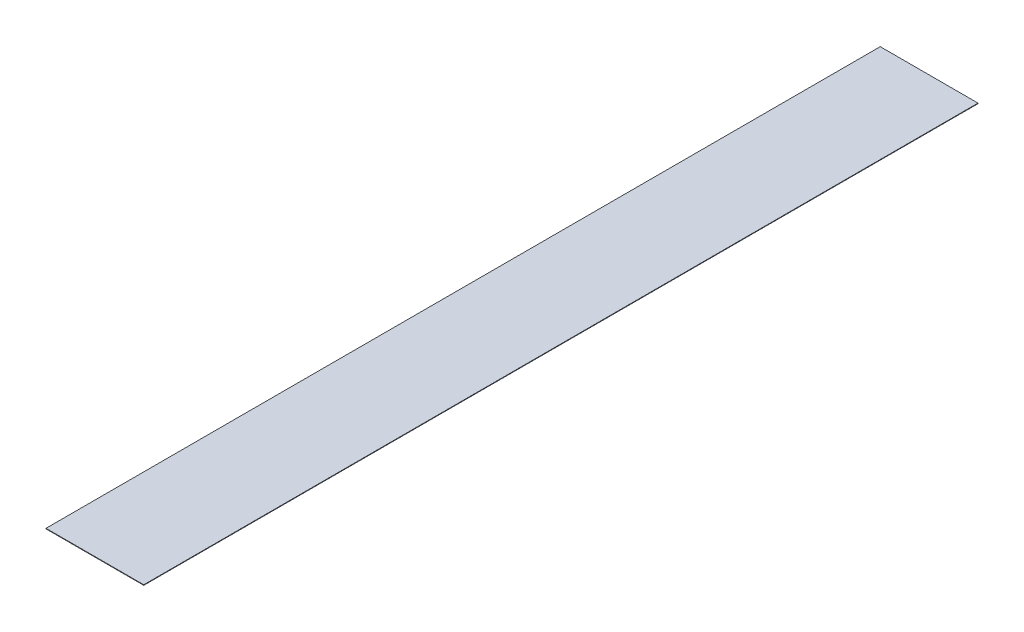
SolidWorks part; units mm, degrees
ref_plane "Front Plane" through (0, 0, 0) normal (0, 0, 1) x (1, 0, 0)
ref_plane "Top Plane" through (0, 0, 0) normal (0, 1, 0) x (1, 0, 0)
ref_plane "Right Plane" through (0, 0, 0) normal (1, 0, 0) x (0, 0, -1)
sketch "Sketch1" plane through (0, 0, 0) normal (0, 1, 0) x (1, 0, 0)
  line L0 (-55, 0) -> (55, 0) construction
  line L1 (0, -55) -> (0, 55) construction
  line L5 (23.8125, -203.2) -> (-23.8125, -203.2)
  line L6 (23.8125, -203.2) -> (23.8125, 203.2)
  line L7 (23.8125, 203.2) -> (-23.8125, 203.2)
  line L8 (-23.8125, -203.2) -> (-23.8125, 203.2)
  point P2 (23.8125, 0)
  point P9 (0, -203.2)
  dimension "D1" = 406.4
  dimension "D2" = 47.625
extrude "Boss-Extrude1" add sketch "Sketch1" along normal blind 0.254
